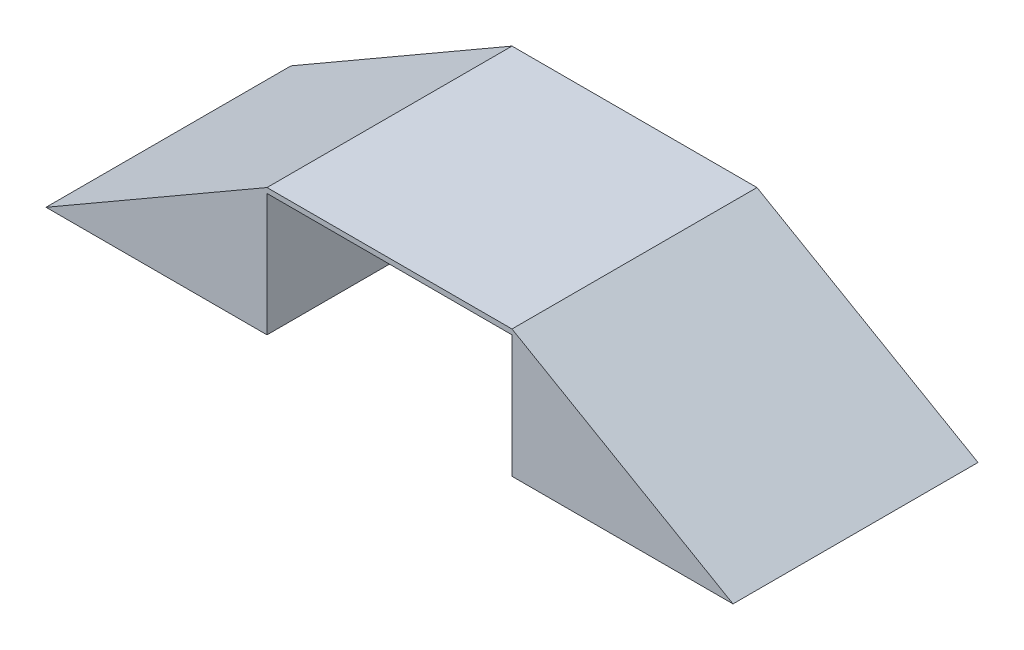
SolidWorks part; units mm, degrees
ref_plane "Front Plane" through (0, 0, 0) normal (0, 0, 1) x (1, 0, 0)
ref_plane "Top Plane" through (0, 0, 0) normal (0, 1, 0) x (1, 0, 0)
ref_plane "Right Plane" through (0, 0, 0) normal (1, 0, 0) x (0, 0, -1)
sketch "Sketch3" plane through (0, 0, 0) normal (0, 0, 1) x (1, 0, 0)
  line L0 (-304.8, 317.5) -> (304.8, 317.5)
  line L1 (304.8, 317.5) -> (854.7261, 0)
  line L2 (854.7261, 0) -> (-854.7261, 0)
  line L3 (-854.7261, 0) -> (-304.8, 317.5)
  point P2 (0, 0)
  dimension "D1" = 30
  dimension "D2" = 30
  dimension "D3" = 609.6
  dimension "D4" = 317.5
  dimension "D5" = 635
  dimension "D6" = 635
extrude "Boss-Extrude1" add sketch "Sketch3" along normal mid plane 609.6
sketch "Sketch5" plane through (0, 0, 304.8) normal (0, 0, 1) x (1, 0, 0)
  line L0 (-854.7261, 0) -> (854.7261, 0) construction
  line L1 (-304.8, 0) -> (304.8, 0)
  line L2 (-304.8, 0) -> (-304.8, 304.8)
  line L3 (-304.8, 304.8) -> (304.8, 304.8)
  line L4 (304.8, 0) -> (304.8, 304.8)
  line L5 (304.8, 317.5) -> (-304.8, 317.5) construction
  dimension "D1" = 12.7
extrude "Cut-Extrude1" cut sketch "Sketch5" against normal blind 609.6
